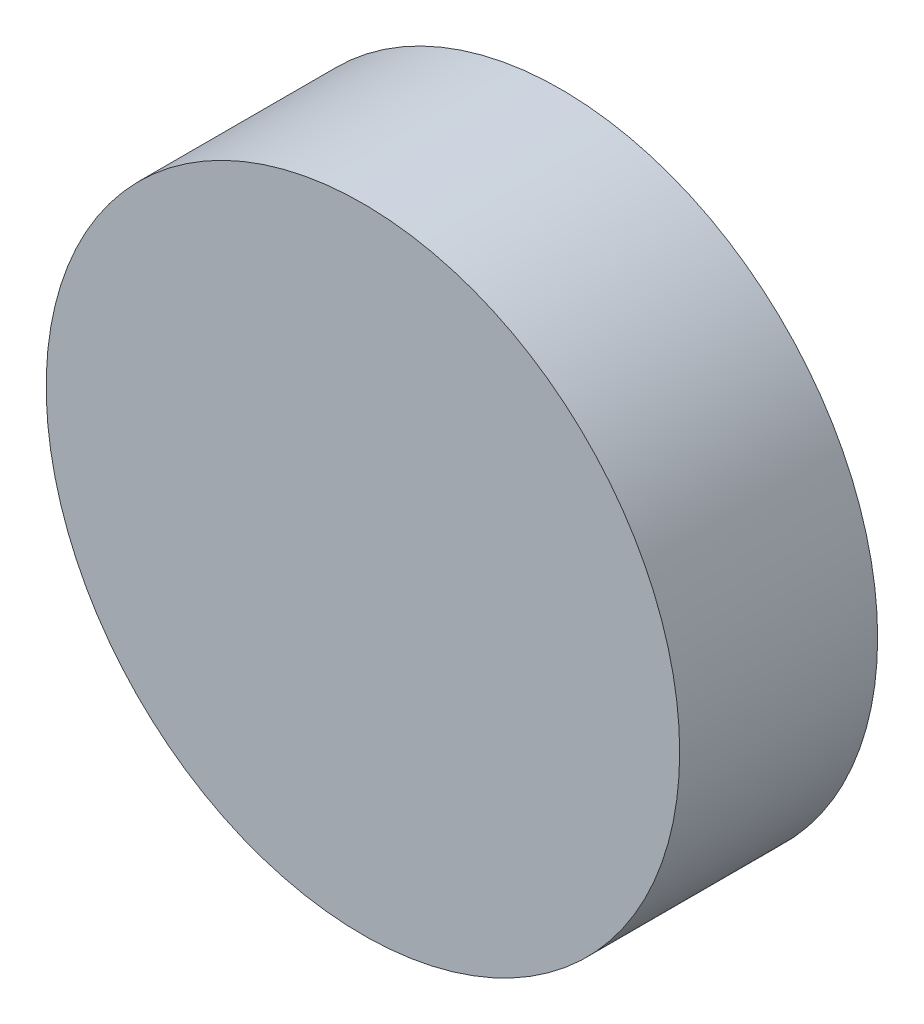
SolidWorks part; units mm, degrees
ref_plane "Front Plane" through (0, 0, 0) normal (0, 0, 1) x (1, 0, 0)
ref_plane "Top Plane" through (0, 0, 0) normal (0, 1, 0) x (1, 0, 0)
ref_plane "Right Plane" through (0, 0, 0) normal (1, 0, 0) x (0, 0, -1)
sketch "Sketch1" plane through (0, 0, 0) normal (0, 0, 1) x (1, 0, 0)
  circle A0 centre (0, 0) radius 80
  dimension "D1" = 160
extrude "Boss-Extrude1" add sketch "Sketch1" along normal blind 50 contours A0
